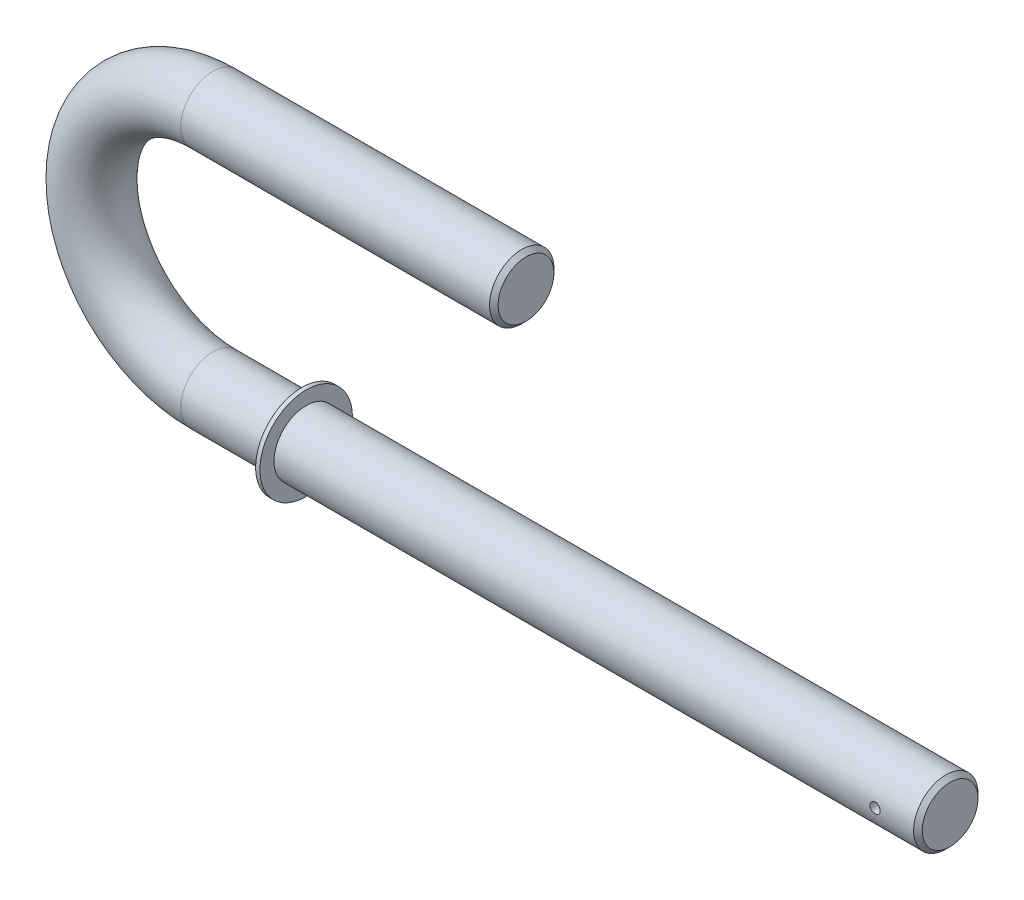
SolidWorks part; units mm, degrees
ref_plane "Plan de face" through (0, 0, 0) normal (0, 0, 1) x (1, 0, 0)
ref_plane "Plan de dessus" through (0, 0, 0) normal (0, 1, 0) x (1, 0, 0)
ref_plane "Plan de droite" through (0, 0, 0) normal (1, 0, 0) x (0, 0, -1)
sketch "Esquisse1" plane through (0, 0, 0) normal (0, 0, 1) x (1, 0, 0)
  line L0 (0, 0) -> (-72.9165, 0)
  line L2 (-72.9165, -56.6) -> (98.7835, -56.6)
  arc A0 (-72.9165, 0) -> (-72.9165, -56.6) centre (-72.9165, -28.3) ccw
  dimension "D1" = 28.3
  dimension "D2" = 200
  dimension "D3" = 72.9165
sketch "Esquisse2" plane through (0, 0, 0) normal (1, 0, 0) x (0, 0, -1)
  circle A0 centre (0, 0) radius 7.5
  dimension "D1" = 15
sweep "Balayage1" add profiles "Esquisse2" path "Esquisse1"
chamfer "Chanfrein1" distance 1 angle 45 2 edges at (0, 0, -7.5) (98.7835, -56.6, -7.5)
sketch "Esquisse3" plane through (0, 0, 0) normal (0, 0, 1) x (1, 0, 0)
  line L0 (98.7835, -63.1) -> (98.7835, -50.1) construction
  line L1 (97.7835, -49.1) -> (-72.9165, -49.1) construction
  circle A0 centre (88.7835, -56.6) radius 1.2
  dimension "D1" = 2.4
  dimension "D2" = 10
  dimension "D3" = 7.5
ref_plane "Plan1" through (-51.21, 0, 0) normal (1, 0, 0) x (0, 0, -1)
sketch "Esquisse4" plane through (-51.21, 0, 0) normal (1, 0, 0) x (0, 0, -1)
  circle A0 centre (0, -56.7003) radius 10.7705
extrude "Extrusion1" add sketch "Esquisse4" against normal blind 1
extrude "Enlèv. mat.-Extru.1" cut sketch "Esquisse3" against normal through all and the other way through all
